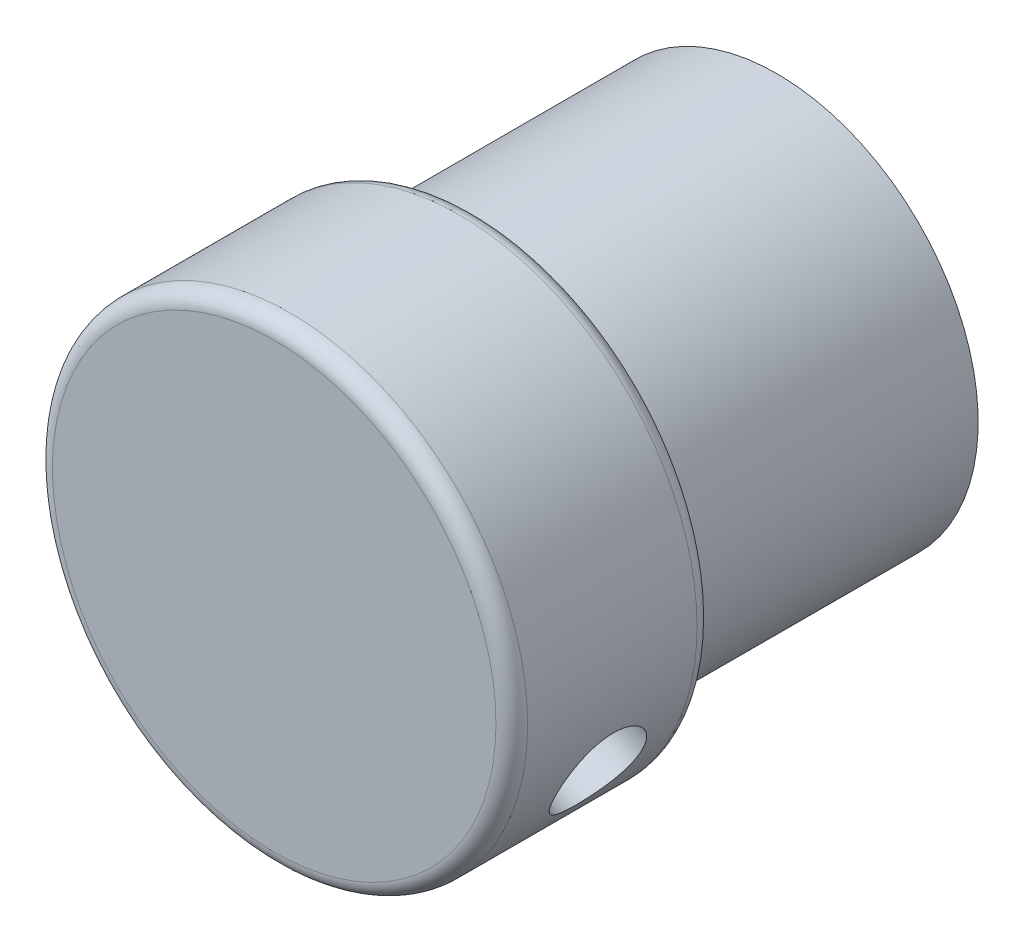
SolidWorks part; units mm, degrees
ref_plane "Front" through (0, 0, 0) normal (0, 0, 1) x (1, 0, 0)
ref_plane "Top" through (0, 0, 0) normal (0, 1, 0) x (1, 0, 0)
ref_plane "Right" through (0, 0, 0) normal (1, 0, 0) x (0, 0, -1)
sketch "Sketch1" plane through (0, 0, 0) normal (0, 0, 1) x (1, 0, 0)
  circle A0 centre (102.3918, 82.5093) radius 12.7
  dimension "D1" = 25.4
extrude "Base-Extrude" add sketch "Sketch1" along normal blind 19.05
sketch "Sketch2" plane through (0, 0, 19.05) normal (0, 0, 1) x (1, 0, 0)
  circle A0 centre (102.3918, 82.5093) radius 15
  circle A1 centre (102.3918, 82.5093) radius 12.7 construction
  dimension "D1" = 30
extrude "Boss-Extrude1" add sketch "Sketch2" along normal blind 12.7
hole_wizard "1/4-20 Tapped Hole1" positions "Sketch4" profile "Sketch3" tap size "1/4-20" standard "Ansi Inch"
sketch "Sketch4" plane through (0, 0, 0) normal (0, 0, -1) x (-1, 0, 0)
  circle A0 centre (-102.3918, 82.5093) radius 12.7 construction
  point P0 (-102.3918, 82.5093)
sketch "Sketch3" plane through (102.3918, 82.5093, 0) normal (1, 0, 0) x (0, 1, 0)
  line L0 (0, 0) -> (0, 20.5838)
  line L1 (0, 20.5838) -> (2.5527, 19.05)
  line L2 (2.5527, 19.05) -> (2.5527, 0)
  line L5 (2.5527, 0) -> (0, 0)
  line L10 (0, 20.5838) -> (-2.5527, 19.05) construction
  line L11 (0, -6.35) -> (0, 107.95) construction
  dimension "Hole Dia." = 5.1054
  dimension "Hole Depth" = 19.05
  dimension "Drill Angle" = 118
fillet "Fillet1" radius 1 3 edges at (115.0918, 82.5093, 19.05) (117.3918, 82.5093, 19.05) (117.3918, 82.5093, 31.75)
sketch3d "3DSketch2"
  point P0 (115.9973, 76.1933, 24.8798)
ref_plane "Plane1" through (115.9973, 76.1933, 24.8798) normal (0.907, -0.4211, 0) x (0, 0, -1)
sketch "Sketch6" plane through (115.9973, 76.1933, 24.8798) normal (0.907, -0.4211, 0) x (0, 0, -1)
  circle A0 centre (0, 0) radius 2.8368
extrude "Cut-Extrude1" cut sketch "Sketch6" against normal through all
